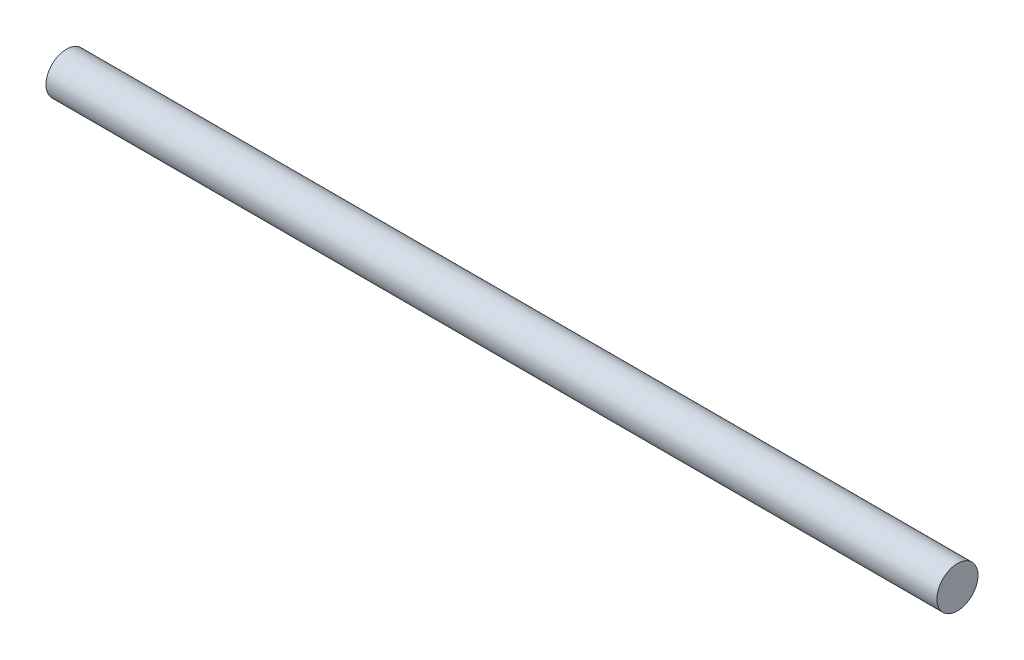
SolidWorks part; units mm, degrees
ref_plane "Front Plane" through (0, 0, 0) normal (0, 0, 1) x (1, 0, 0)
ref_plane "Top Plane" through (0, 0, 0) normal (0, 1, 0) x (1, 0, 0)
ref_plane "Right Plane" through (0, 0, 0) normal (1, 0, 0) x (0, 0, -1)
sketch "Sketch1" plane through (0, 0, 0) normal (1, 0, 0) x (0, 0, -1)
  circle A0 centre (0, 0) radius 1.5
  dimension "D1" = 3
extrude "Boss-Extrude1" add sketch "Sketch1" along normal blind 65
